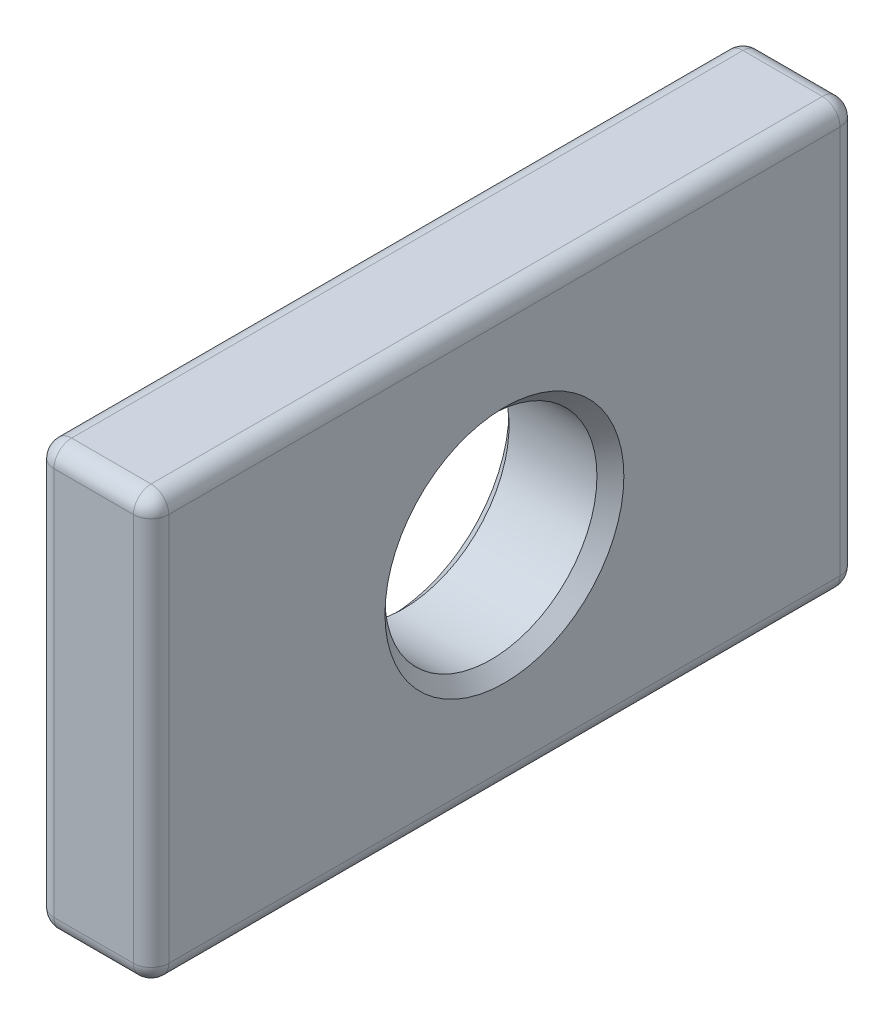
SolidWorks part; units mm, degrees
ref_plane "Front Plane" through (0, 0, 0) normal (0, 0, 1) x (1, 0, 0)
ref_plane "Top Plane" through (0, 0, 0) normal (0, 1, 0) x (1, 0, 0)
ref_plane "Right Plane" through (0, 0, 0) normal (1, 0, 0) x (0, 0, -1)
sketch "Sketch1" plane through (0, 0, 0) normal (1, 0, 0) x (0, 0, -1)
  line L1 (-20, 12) -> (20, 12)
  line L2 (-20, 12) -> (-20, -12)
  line L3 (-20, -12) -> (20, -12)
  line L4 (20, 12) -> (20, -12)
  line L5 (-20, 12) -> (20, -12) construction
  line L6 (-20, -12) -> (20, 12) construction
  circle A0 centre (0, 0) radius 6
  point P0 (0, 0)
  dimension "D3" = 12
  dimension "D1" = 24
  dimension "D2" = 40
extrude "Boss-Extrude1" add sketch "Sketch1" along normal mid plane 6.5
fillet "Fillet1" radius 1 12 edges at (0, -12, -20) (0, 12, -20) (-3.25, 12, 0) (-3.25, -12, 0) (-3.25, 0, -20) (0, 12, 20) (0, -12, 20) (-3.25, 0, 20) (3.25, -12, 0) (3.25, 0, 20) (3.25, 12, 0) (3.25, 0, -20)
chamfer "Chamfer1" distance 0.762 angle 45 2 edges at (-3.25, 0, -6) (3.25, 0, -6)
